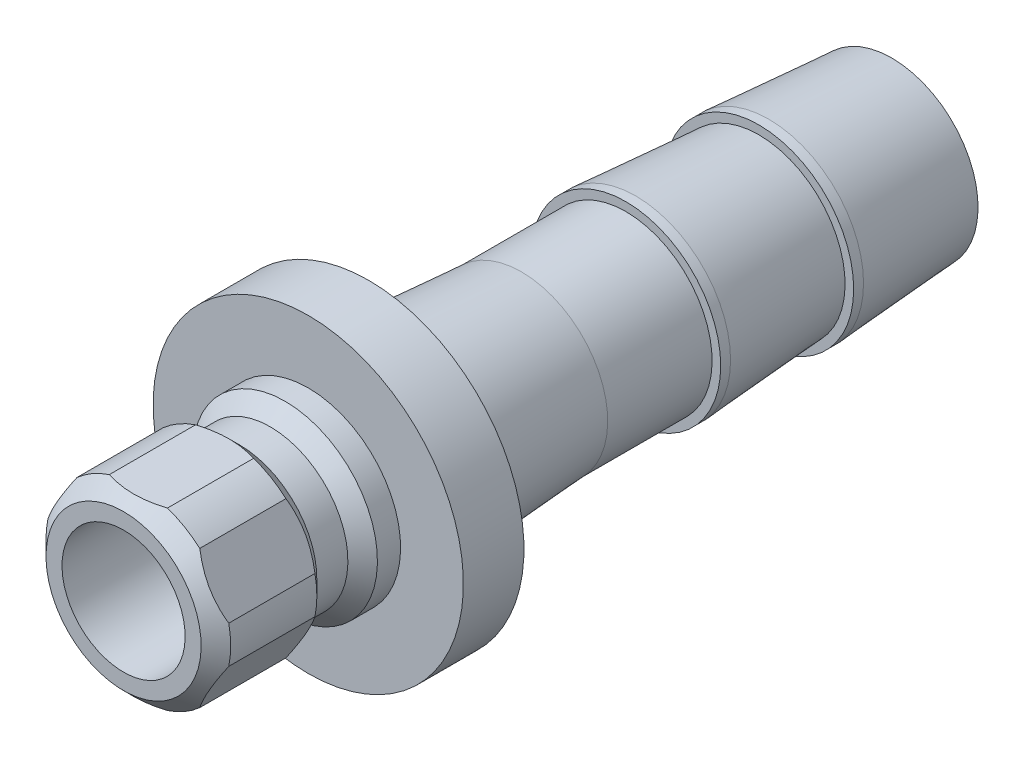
SolidWorks part; units mm, degrees
ref_plane "Front Plane" through (0, 0, 0) normal (0, 0, 1) x (1, 0, 0)
ref_plane "Top Plane" through (0, 0, 0) normal (0, 1, 0) x (1, 0, 0)
ref_plane "Right Plane" through (0, 0, 0) normal (1, 0, 0) x (0, 0, -1)
sketch "Sketch1" plane through (0, 0, 0) normal (1, 0, 0) x (0, 0, -1)
  line L0 (0, 0) -> (-12.7, 0) construction
  line L1 (-9.525, 3.175) -> (-9.525, 4.0005)
  line L2 (-3.556, 4.0005) -> (-3.556, 0) construction
  line L3 (-8.763, 4.7625) -> (-4.318, 4.7625)
  line L4 (0, 8.001) -> (0, 0) construction
  line L5 (-3.556, 4.0005) -> (-1.9558, 4.0005)
  line L6 (-1.1938, 4.7625) -> (0, 4.7625)
  line L7 (0, 4.7625) -> (0, 8.001)
  line L8 (-3.556, 4.0005) -> (-4.318, 4.7625)
  line L9 (-1.9558, 4.0005) -> (-1.1938, 4.7625)
  line L10 (-9.525, 4.0005) -> (-8.763, 4.7625)
  line L11 (-9.525, 3.175) -> (30.099, 3.175)
  line L12 (0, 8.001) -> (3.1242, 8.001)
  line L13 (3.1242, 8.001) -> (3.1242, 4.8895)
  line L14 (3.1242, 4.8895) -> (4.6482, 4.8895)
  line L15 (0, 0) -> (28.0489, 0) construction
  line L16 (4.6482, 4.8895) -> (10.9982, 4.445)
  line L17 (23.749, 4.8895) -> (23.241, 4.8895)
  line L18 (10.9982, 4.445) -> (16.383, 4.445)
  line L20 (16.891, 4.8895) -> (23.241, 4.445)
  line L22 (23.749, 4.8895) -> (30.099, 4.445)
  line L23 (30.099, 4.445) -> (30.099, 3.175)
  line L24 (23.241, 4.8895) -> (23.241, 4.445)
  line L25 (16.891, 4.8895) -> (16.383, 4.8895)
  line L26 (16.383, 4.8895) -> (16.383, 4.445)
  dimension "D1" = 9.525
  dimension "D2" = 1.6002
  dimension "D3" = 0.762
  dimension "D4" = 45
  dimension "D5" = 5.969
  dimension "D6" = 45
  dimension "D7" = 39.624
  dimension "D8" = 26.9748
  dimension "D9" = 16.002
  dimension "D11" = 9.779
  dimension "D12" = 6.35
  dimension "D13" = 6.35
  dimension "D14" = 9.525
  dimension "D15" = 0.508
  dimension "D16" = 1.524
  dimension "D17" = 8.89
revolve "Revolve1" add sketch "Sketch1" angle 360 about L0
sketch "Sketch2" plane through (0, 0, 9.525) normal (0, 0, 1) x (1, 0, 0)
  line L1 (-2.6103, 4.5212) -> (-5.2206, 0)
  line L2 (-5.2206, 0) -> (-2.6103, -4.5212)
  line L3 (-2.6103, -4.5212) -> (2.6103, -4.5212)
  line L4 (2.6103, -4.5212) -> (5.2206, 0)
  line L5 (5.2206, 0) -> (2.6103, 4.5212)
  line L6 (2.6103, 4.5212) -> (-2.6103, 4.5212)
  circle A0 centre (0, 0) radius 4.5212 construction
  dimension "D1" = 9.0424
extrude "Cut-Extrude1" cut sketch "Sketch2" against normal blind 6.35 flip side to cut
